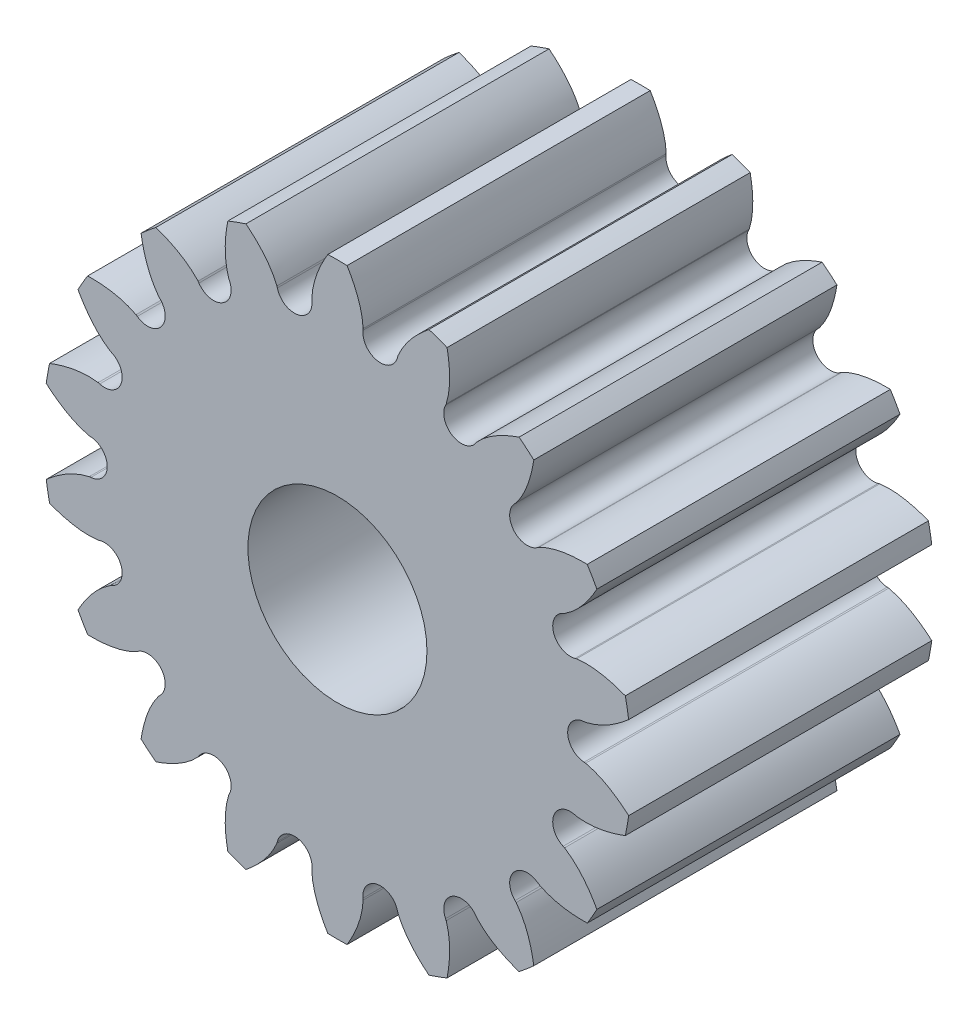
SolidWorks part; units mm, degrees
ref_plane "Front Plane" through (0, 0, 0) normal (0, 0, 1) x (1, 0, 0)
ref_plane "Top Plane" through (0, 0, 0) normal (0, 1, 0) x (1, 0, 0)
ref_plane "Right Plane" through (0, 0, 0) normal (1, 0, 0) x (0, 0, -1)
sketch "Involute construction sketch" plane through (0, 0, 0) normal (0, 0, 1) x (1, 0, 0)
  line L0 (0, 0) -> (-1.8157, 1.6751) construction
  line L1 (0, 0) -> (-1.2188, 2.1487) construction
  line L2 (0, 0) -> (-0.506, 2.418) construction
  line L3 (0, 0) -> (0.255, 2.4572) construction
  line L4 (-2.4509, 0.3098) -> (-2.2398, 1.042) construction
  line L5 (-2.2398, 1.042) -> (-1.8157, 1.6751) construction
  line L6 (-1.8157, 1.6751) -> (-1.2188, 2.1487) construction
  line L7 (0, 0) -> (-2.2398, 1.042) construction
  line L8 (0, 0) -> (-2.4509, 0.3098) construction
  line L9 (-1.2188, 2.1487) -> (-0.506, 2.418) construction
  line L10 (-0.506, 2.418) -> (0.255, 2.4572) construction
  line L11 (-2.4509, 0.3098) -> (-1.9731, 4.0897) construction
  line L12 (-2.2398, 1.042) -> (-0.9542, 3.8056) construction
  line L13 (-1.8157, 1.6751) -> (-0.2657, 3.3553) construction
  line L14 (-1.2188, 2.1487) -> (0.1068, 2.9007) construction
  line L15 (-0.506, 2.418) -> (0.2399, 2.5741) construction
  line L17 (0, 0) -> (0, 5.7859) construction
  line L18 (0, 0) -> (0.2291, 2.6189) construction
  line L19 (0, 0) -> (0.397, 2.2513) construction
  circle A0 centre (0, 0) radius 2.286 construction
  circle A1 centre (0, 0) radius 2.4704 construction
  circle A2 centre (0, 0) radius 2.6289 construction
  circle A3 centre (0, 0) radius 2.921 construction
  spline S0 degree 3 poles (0.255, 2.4572) (0.2476, 2.615) (0.11, 2.9502) (-0.5314, 3.7068) (-1.3595, 4.0133) (-1.9731, 4.0897) knots 0 0 0 0 0.160126 0.360107 1 1 1 1 construction
  point P17 (0.0957, 2.9194)
sketch "Sketch2" plane through (0, 0, 0) normal (0, 0, 1) x (1, 0, 0)
  line L0 (0, 2.921) -> (0, 2.286)
  line L1 (0, 0) -> (0, 5.7859) construction
  line L2 (0.255, 2.4572) -> (0.2534, 2.4415)
  line L3 (0, 0) -> (0.255, 2.4572) construction
  circle A0 centre (0, 0) radius 2.921 construction
  circle A1 centre (0, 0) radius 2.286 construction
  arc A2 (0, 2.921) -> (0.0957, 2.9194) centre (0, 0) cw
  arc A3 (0, 2.286) -> (0.397, 2.2513) centre (0, 0) cw
  arc A4 (0.2534, 2.4415) -> (0.397, 2.2513) centre (0.4273, 2.4235) ccw
  spline S0 degree 3 poles (0.255, 2.4572) (0.2525, 2.512) (0.2249, 2.6747) (0.152, 2.8255) (0.0957, 2.9194) knots 0 0 0 0 0.332628 1 1 1 1
sketch "Sketch3" plane through (0, 0, 0) normal (0, 0, 1) x (1, 0, 0)
  circle A0 centre (0, 0) radius 2.286
  circle A1 centre (0, 0) radius 0.889
extrude "Base" add sketch "Sketch3" along normal blind 3.0099
extrude "Half tooth" add sketch "Sketch2" along normal up to surface (3.0099 mm away)
ref_plane "Midplane of half tooth" through (0, 0, 0) normal (-1, 0, 0) x (0, 0, 1)
mirror "Mirror of half tooth" about plane through (0, 0, 0) normal (-1, 0, 0) of "Half tooth"
pattern_circular "Pattern of half tooth" count 18 over 360 of "Half tooth", "Mirror of half tooth"
equation "\"radtodeg\"= 180 / PI'radian to degree conversion [ ]"
equation "\"phi\"= 20'pressure angle [deg]"
equation "\"N\"= 18'number of teeth [teeth]"
equation "\"A\"= 0.230in'diameter of addendum circle [inch]"
equation "\"B\"= 0.18in'diameter of dedendum circle [inch]"
equation "\"P\"= ( \"N\" + 2 ) / \"A\"'diametral pitch [teeth/inch]"
equation "\"d\"= \"N\" / \"P\"'diameter of pitch circle [inch]"
equation "\"cp\"= PI / \"P\"'circular pitch [inch/teeth]"
equation "\"add\"= 1 / \"P\"'addendum [inch]"
equation "\"ded\"= - ( \"B\" - \"d\" ) / 2'dedendum [inch]"
equation "\"clear\"= \"ded\" - \"add\"'clearance [inch]"
equation "\"C\"= \"B\" + 2 * \"clear\"'diameter of clearance circle [inch]"
equation "\"h\"= \"add\" + \"ded\"'tooth height / whole depth [inch]"
equation "\"s\"= \"d\" * cos ( \"phi\" * 1 / \"radtodeg\" )'diameter of base circle [inch]"
equation "\"t\"= ( PI / 2 ) / \"P\"'tooth width at diameter of pitch circle diameter [inch]"
equation "\"alpha\"= ( \"t\" / ( \"d\" / 2 ) * \"radtodeg\" ) / 2'arc angle for half of tooth width at pitch circle diameter [inch]"
equation "\"bore\"= 0.07'bore of hub [inch]"
equation "\"D4@Involute construction sketch\"= \"A\"'addendum circle"
equation "\"D3@Involute construction sketch\"= \"d\"'pitch circle"
equation "\"D2@Involute construction sketch\"= \"s\"'base circle"
equation "\"D1@Involute construction sketch\"= \"B\"'dedendum circle"
equation "\"seg\"= \"D5@Involute construction sketch\"'size of one involute segment [inch]"
equation "\"D6@Involute construction sketch\"=2*\"seg\""
equation "\"D7@Involute construction sketch\"=3*\"seg\""
equation "\"D8@Involute construction sketch\"=4*\"seg\""
equation "\"D9@Involute construction sketch\"=5*\"seg\""
equation "\"D10@Involute construction sketch\"=\"alpha\""
equation "\"D11@Involute construction sketch\"=2*\"alpha\""
equation "\"D1@Sketch3\"=\"B\""
equation "\"D2@Sketch3\"=\"bore\""
